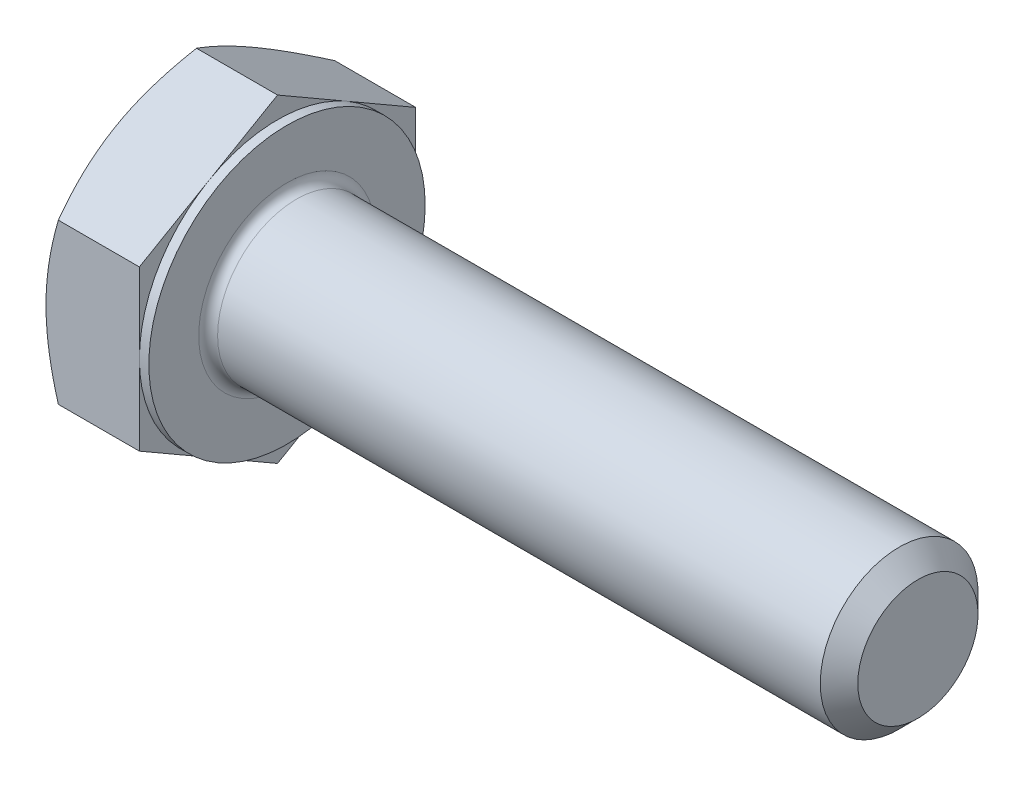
SolidWorks part; units mm, degrees
extrude "BaseHead" add sketch "Sketch1" along normal blind 4.1402
sketch "Sketch1" plane through (0, 0, 0) normal (1, 0, 0) x (0, 0, -1)
  line L0 (5.5626, 3.2116) -> (5.5626, -3.2116)
  line L1 (-5.5626, 3.2116) -> (-5.5626, -3.2116)
  line L2 (5.5626, -3.2116) -> (0, -6.4231)
  line L3 (0, -6.4231) -> (-5.5626, -3.2116)
  line L4 (5.5626, 3.2116) -> (0, 6.4231)
  line L5 (0, 6.4231) -> (-5.5626, 3.2116)
revolve "HeadChamfer" cut sketch "Sketch3" angle 360 about L6
sketch "Sketch3" plane through (0, 0, 0) normal (0, 0, 1) x (1, 0, 0)
  line L0 (0, 5.5626) -> (4.163, 12.7731)
  line L1 (0, 6.4231) -> (0, 3.2116) construction
  line L2 (4.163, 12.7731) -> (4.163, 19.1231)
  line L3 (4.163, 19.1231) -> (-12.7, 19.1231)
  line L4 (-12.7, 19.1231) -> (-12.7, 5.5626)
  line L5 (-12.7, 5.5626) -> (0, 5.5626)
  line L6 (0, 0) -> (99.06, 0) construction
  line L7 (4.1402, 6.4231) -> (0, 6.4231) construction
ref_plane "Plane1" through (0, 0, 0) normal (0, 0, 1) x (1, 0, 0)
ref_plane "Plane2" through (0, 0, 0) normal (0, 1, 0) x (1, 0, 0)
ref_plane "Plane3" through (0, 0, 0) normal (1, 0, 0) x (0, 0, -1)
sketch "BodySke" plane through (0, 0, 0) normal (0, 0, 1) x (1, 0, 0)
  line L0 (0, 3.2116) -> (0, -3.2116) construction
  line L1 (0, 0) -> (29.5402, 0)
  line L2 (0, 0) -> (0, 3.175)
  line L3 (0, 3.175) -> (28.7845, 3.175)
  line L4 (29.5402, 0) -> (29.5402, 2.4193)
  line L5 (4.1402, 6.4231) -> (4.1402, 3.2116) construction
  line L6 (29.5402, 2.4193) -> (28.7845, 3.175)
  line L7 (0, 0) -> (96.52, 0) construction
  line L8 (29.5402, -2.4193) -> (28.7845, -3.175) construction
  line L9 (0, -3.175) -> (28.7845, -3.175) construction
  line L10 (5.4102, 15.24) -> (5.4102, -1.27) construction
  line L11 (4.1402, 15.24) -> (4.1402, -1.27) construction
  line L12 (4.1402, 3.2116) -> (4.1402, -3.2116) construction
revolve "BaseBody" add sketch "BodySke" angle 360 about L7
sketch "Sketch4" plane through (0, 0, 0) normal (0, 0, 1) x (1, 0, 0)
  line L1 (4.1402, 6.4231) -> (4.1402, 3.2116) construction
  line L2 (4.1402, 5.5626) -> (3.7592, 5.5626)
  line L3 (4.1402, 5.5626) -> (4.1402, 31.8231)
  line L4 (4.1402, 31.8231) -> (3.7592, 31.8231)
  line L5 (0, 0) -> (95.25, 0) construction
  line L6 (0, 0) -> (96.52, 0) construction
  line L7 (3.7592, 5.5626) -> (3.7592, 31.8231)
  line L8 (4.1402, 6.4231) -> (0.4968, 6.4231) construction
revolve "BearingFace" cut sketch "Sketch4" angle 360 about L5
fillet "HeadFillet" radius 0.381 1 edges at (4.1402, 0, -3.175)
sketch "ThdSchSke" plane through (0, 0, 0) normal (0, 0, 1) x (1, 0, 0)
  line L0 (5.4102, -2.4193) -> (4.8811, -3.175)
  line L1 (5.4102, -2.4193) -> (5.9393, -3.175)
  line L2 (5.9393, -3.175) -> (5.9393, -3.9688)
  line L3 (-3.175, 0) -> (5.1513, 0) construction
  line L5 (5.9393, -3.9688) -> (4.8811, -3.9688)
  line L6 (4.8811, -3.9688) -> (4.8811, -3.175)
revolve "ThreadSchematic" [suppressed] cut sketch "ThdSchSke" angle 360 about L3
pattern_linear "ThdSchPat" [suppressed]
equation "\"D3@Sketch1\" = \"Width_flats@Sketch1\" / 2"
equation "\"D4@Sketch1\" = \"D3@Sketch1\""
equation "\"D5@Sketch1\" = \"D4@Sketch1\""
equation "\"Thread_minor@ThreadCosmetic\" = \"Minor_dia@BodySke\""
equation "\"D1@Sketch3\" = \"Width_flats@Sketch1\" / 2"
equation "\"D1@Sketch4\" = \"Width_flats@Sketch1\" / 2"
equation "\"Thread_length@ThreadCosmetic\" = ((sgn( (\"Length@BodySke\" - \"Advance@BodySke\" ) - \"Thread_nom@BodySke\" )-1)*( (\"Length@BodySke\" - \"Advance@BodySke\" ) - \"Thread_nom@BodySke\" ))/-2+ \"Thread_nom@BodySke\""
equation "\"Thread_minor@ThdSchSke\" = \"Minor_dia@BodySke\""
equation "\"Diameter@ThdSchSke\" = \"Diameter@BodySke\""
equation "\"Overcut@ThdSchSke\" = \"Diameter@BodySke\" * 1.25"
equation "\"Start@ThdSchSke\" = \"Head_ht@BaseHead\" + \"Length@BodySke\" - \"Thread_length@ThreadCosmetic\"  '---Non-countersunk---"
equation "\"Num_threads@ThdSchPat\" = int( \"Thread_length@ThreadCosmetic\" / \"Advance@BodySke\" + 0.999 )  + 1"
equation "\"Advance@ThdSchPat\" = \"Thread_length@ThreadCosmetic\" /  (\"Num_threads@ThdSchPat\" - 1) 'relax it"
equation "\"Num_threads@ThdSchPat\" = \"Num_threads@ThdSchPat\" - sgn( \"Num_threads@ThdSchPat\" - 1) '---chamfered tips only---"
